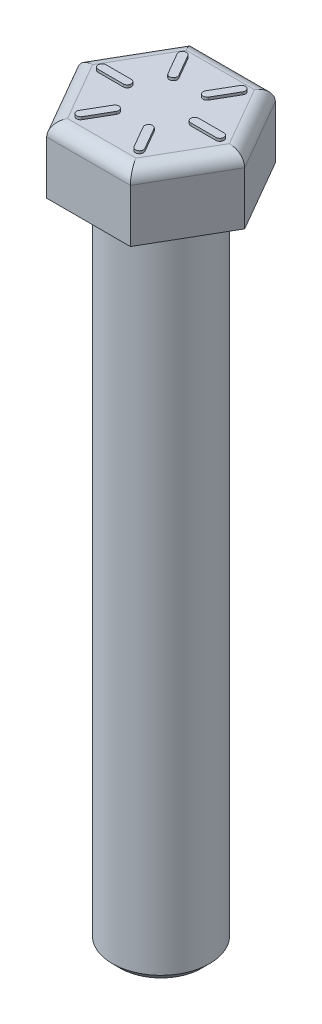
SolidWorks part; units mm, degrees
ref_plane "Front" through (0, 0, 0) normal (0, 0, 1) x (1, 0, 0)
ref_plane "Top" through (0, 0, 0) normal (0, 1, 0) x (1, 0, 0)
ref_plane "Right" through (0, 0, 0) normal (1, 0, 0) x (0, 0, -1)
sketch "Sketch1" plane through (0, 0, 0) normal (0, 1, 0) x (1, 0, 0)
  circle A0 centre (0, 0) radius 4.6609
  dimension "D1" = 9.3218
extrude "Boss-Extrude1" add sketch "Sketch1" against normal blind 63.5
sketch "Sketch2" plane through (0, 0, 0) normal (0, 1, 0) x (1, 0, 0)
  line L1 (8.0289, 0) -> (4.0145, 6.9532)
  line L2 (4.0145, 6.9532) -> (-4.0145, 6.9532)
  line L3 (-4.0145, 6.9532) -> (-8.0289, 0)
  line L4 (-8.0289, 0) -> (-4.0145, -6.9532)
  line L5 (-4.0145, -6.9532) -> (4.0145, -6.9532)
  line L6 (4.0145, -6.9532) -> (8.0289, 0)
  circle A0 centre (0, 0) radius 6.9532 construction
  dimension "D1" = 13.9065
extrude "Boss-Extrude2" add sketch "Sketch2" along normal blind 6.35
fillet "Fillet1" radius 1.27 6 edges at (0, 6.35, 6.9532) (-6.0217, 6.35, 3.4766) (-6.0217, 6.35, -3.4766) (0, 6.35, -6.9532) (6.0217, 6.35, -3.4766) (6.0217, 6.35, 3.4766)
chamfer "Chamfer1" distance 0.762 angle 45 1 edges at (0, -63.5, 4.6609)
sketch "Sketch3" plane through (0, 6.35, 0) normal (0, 1, 0) x (1, 0, 0)
  line L0 (5.6515, 0) -> (3.2385, 0) construction
  line L1 (5.6515, -0.381) -> (3.2385, -0.381)
  line L2 (5.6515, 0.381) -> (3.2385, 0.381)
  line L3 (2.8258, 4.8943) -> (1.6193, 2.8046) construction
  line L4 (3.1557, 4.7038) -> (1.9492, 2.6141)
  line L5 (2.4958, 5.0848) -> (1.2893, 2.9951)
  line L6 (-2.8257, 4.8943) -> (-1.6192, 2.8046) construction
  line L7 (-2.4958, 5.0848) -> (-1.2893, 2.9951)
  line L8 (-3.1557, 4.7038) -> (-1.9492, 2.6141)
  line L9 (-5.6515, 0) -> (-3.2385, 0) construction
  line L10 (-5.6515, 0.381) -> (-3.2385, 0.381)
  line L11 (-5.6515, -0.381) -> (-3.2385, -0.381)
  line L12 (-2.8258, -4.8943) -> (-1.6193, -2.8046) construction
  line L13 (-3.1557, -4.7038) -> (-1.9492, -2.6141)
  line L14 (-2.4958, -5.0848) -> (-1.2893, -2.9951)
  line L15 (2.8258, -4.8943) -> (1.6192, -2.8046) construction
  line L16 (2.4958, -5.0848) -> (1.2893, -2.9951)
  line L17 (3.1557, -4.7038) -> (1.9492, -2.6141)
  arc A0 (5.6515, -0.381) -> (5.6515, 0.381) centre (5.6515, 0) ccw
  arc A1 (3.2385, 0.381) -> (3.2385, -0.381) centre (3.2385, 0) ccw
  circle A2 centre (0, 0) radius 2.8575 construction
  arc A3 (3.1557, 4.7038) -> (2.4958, 5.0848) centre (2.8258, 4.8943) ccw
  arc A4 (1.2893, 2.9951) -> (1.9492, 2.6141) centre (1.6193, 2.8046) ccw
  arc A5 (-2.4958, 5.0848) -> (-3.1557, 4.7038) centre (-2.8257, 4.8943) ccw
  arc A6 (-1.9492, 2.6141) -> (-1.2893, 2.9951) centre (-1.6192, 2.8046) ccw
  arc A7 (-5.6515, 0.381) -> (-5.6515, -0.381) centre (-5.6515, 0) ccw
  arc A8 (-3.2385, -0.381) -> (-3.2385, 0.381) centre (-3.2385, 0) ccw
  arc A9 (-3.1557, -4.7038) -> (-2.4958, -5.0848) centre (-2.8258, -4.8943) ccw
  arc A10 (-1.2893, -2.9951) -> (-1.9492, -2.6141) centre (-1.6193, -2.8046) ccw
  arc A11 (2.4958, -5.0848) -> (3.1557, -4.7038) centre (2.8258, -4.8943) ccw
  arc A12 (1.9492, -2.6141) -> (1.2893, -2.9951) centre (1.6192, -2.8046) ccw
  point P3 (4.445, 0)
  point P8 (6.0325, 0)
  point P9 (2.8575, 0)
  point P16 (2.2225, 3.8495)
  point P21 (3.0163, 5.2243)
  point P22 (1.4288, 2.4747)
  point P25 (-2.2225, 3.8495)
  point P30 (-3.0162, 5.2243)
  point P31 (-1.4287, 2.4747)
  point P34 (-4.445, 0)
  point P39 (-6.0325, 0)
  point P40 (-2.8575, 0)
  point P43 (-2.2225, -3.8495)
  point P48 (-3.0163, -5.2243)
  point P49 (-1.4288, -2.4747)
  point P52 (2.2225, -3.8495)
  point P57 (3.0163, -5.2243)
  point P58 (1.4288, -2.4747)
  point P59 (0, 0)
  dimension "D4" = 5.715
  dimension "D1" = 0.762
  dimension "D2" = 3.175
  dimension "D3" = 6.0325
  dimension "D5" = 6
extrude "Boss-Extrude3" add sketch "Sketch3" along normal blind 0.254
